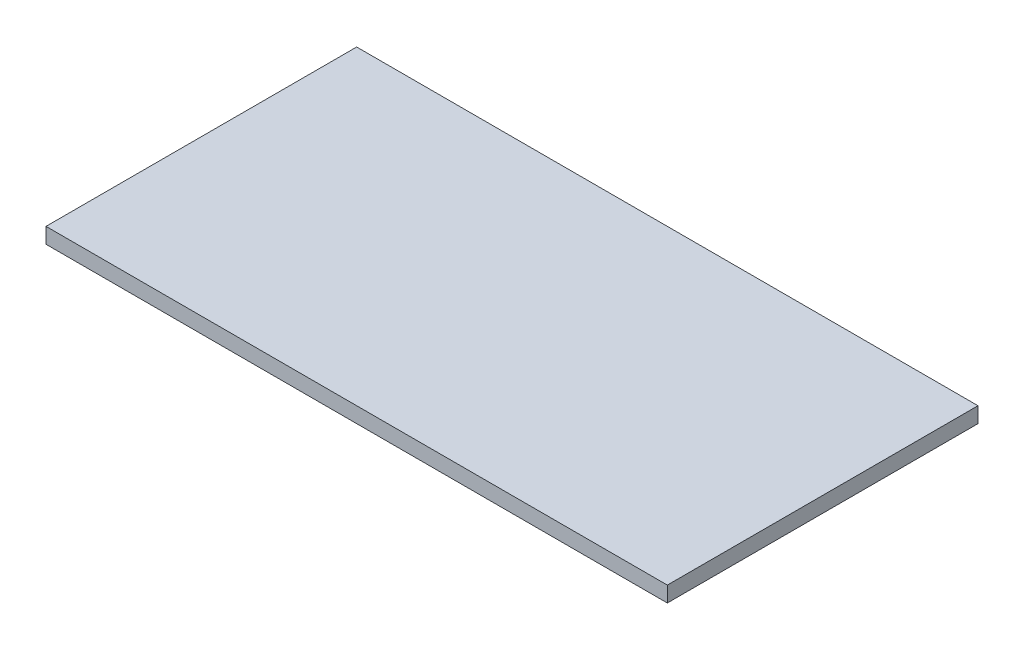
SolidWorks part; units mm, degrees
ref_plane "Plan de face" through (0, 0, 0) normal (0, 0, 1) x (1, 0, 0)
ref_plane "Plan de dessus" through (0, 0, 0) normal (0, 1, 0) x (1, 0, 0)
ref_plane "Plan de droite" through (0, 0, 0) normal (1, 0, 0) x (0, 0, -1)
sketch "Esquisse1" plane through (0, 0, 0) normal (0, 0, 1) x (1, 0, 0)
  line L1 (0, 0) -> (2000, 0)
  line L2 (0, 0) -> (0, 50)
  line L3 (0, 50) -> (2000, 50)
  line L4 (2000, 0) -> (2000, 50)
  dimension "D1" = 2000
  dimension "D2" = 50
extrude "Boss.-Extru.1" add sketch "Esquisse1" along normal blind 1000
